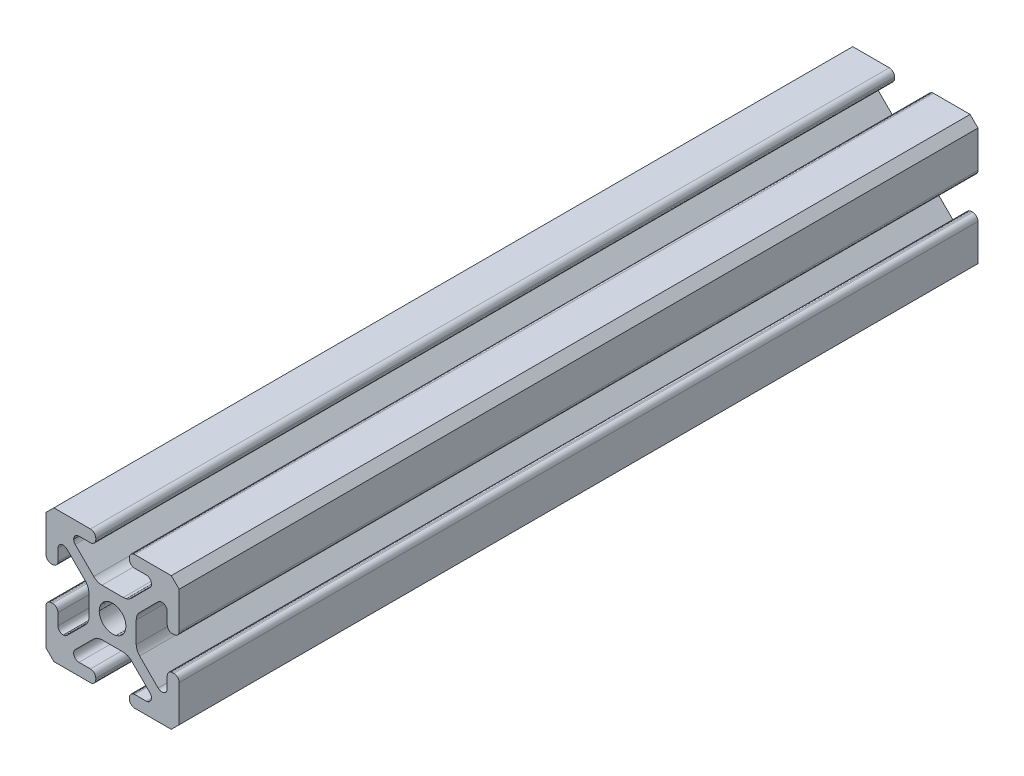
SolidWorks part; units mm, degrees
ref_plane "Front Plane" through (0, 0, 0) normal (0, 0, 1) x (1, 0, 0)
ref_plane "Top Plane" through (0, 0, 0) normal (0, 1, 0) x (1, 0, 0)
ref_plane "Right Plane" through (0, 0, 0) normal (1, 0, 0) x (0, 0, -1)
imported_body "1010C.STEP<1>"
scale "Scale1" scale about centroid uniform scaling yes scale factor 0.782
